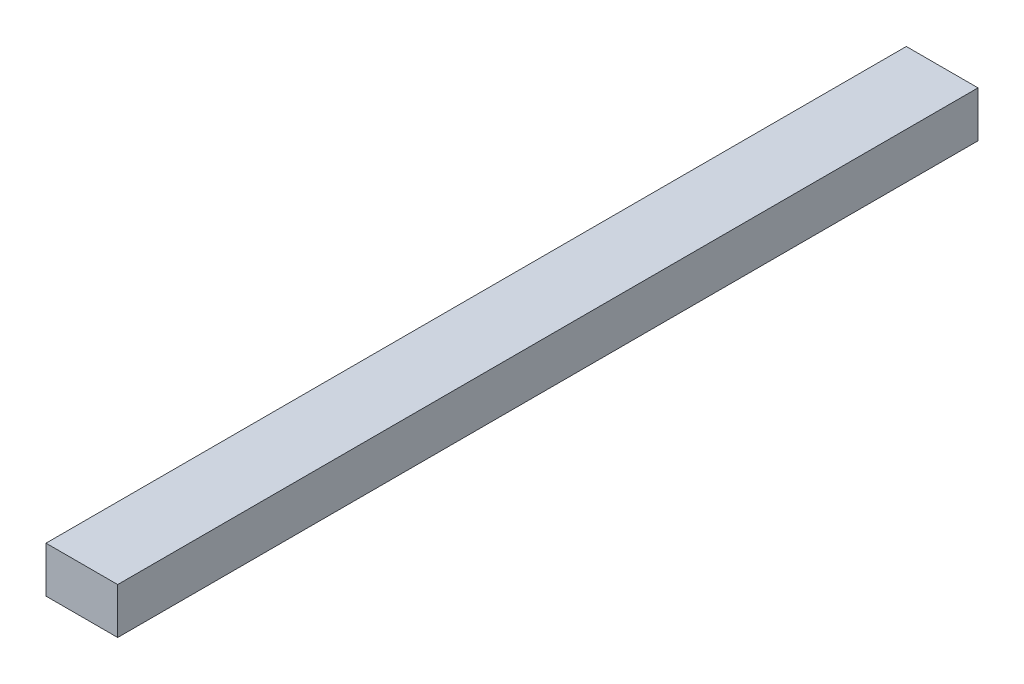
SolidWorks part; units mm, degrees
ref_plane "Alzado" through (0, 0, 0) normal (0, 0, 1) x (1, 0, 0)
ref_plane "Planta" through (0, 0, 0) normal (0, 1, 0) x (1, 0, 0)
ref_plane "Vista lateral" through (0, 0, 0) normal (1, 0, 0) x (0, 0, -1)
sketch "Croquis1" plane through (0, 0, 0) normal (0, 0, 1) x (1, 0, 0)
  line L0 (27.5, 17.5) -> (-27.5, -17.5) construction
  line L1 (-27.5, 17.5) -> (27.5, 17.5)
  line L2 (-27.5, 17.5) -> (-27.5, -17.5)
  line L3 (-27.5, -17.5) -> (27.5, -17.5)
  line L4 (27.5, 17.5) -> (27.5, -17.5)
extrude "Extruir1" add sketch "Croquis1" along normal mid plane 600
sketch "Croquis2" plane through (0, 0, 0) normal (0, 0, 1) x (1, 0, 0)
  line L0 (-25, 16) -> (-25, -16)
  line L1 (-25, -16) -> (25, -16)
  line L2 (25, -16) -> (25, 16)
  line L3 (25, 16) -> (-25, 16)
  line L4 (25, 16) -> (-25, -16) construction
  line L9 (-27.5, 17.5) -> (-27.5, -17.5)
  line L10 (-27.5, -17.5) -> (27.5, -17.5)
  line L11 (27.5, -17.5) -> (27.5, 17.5)
  line L12 (27.5, 17.5) -> (-27.5, 17.5)
  line L13 (-27.5, 17.5) -> (-27.5, -17.5)
  line L14 (-27.5, -17.5) -> (27.5, -17.5)
  line L15 (27.5, -17.5) -> (27.5, 17.5)
  line L16 (27.5, 17.5) -> (-27.5, 17.5)
  dimension "D1" = 0
  dimension "D2" = 50
  dimension "D3" = 32
extrude "Cepillado" cut sketch "Croquis2" against normal through all and the other way through all
